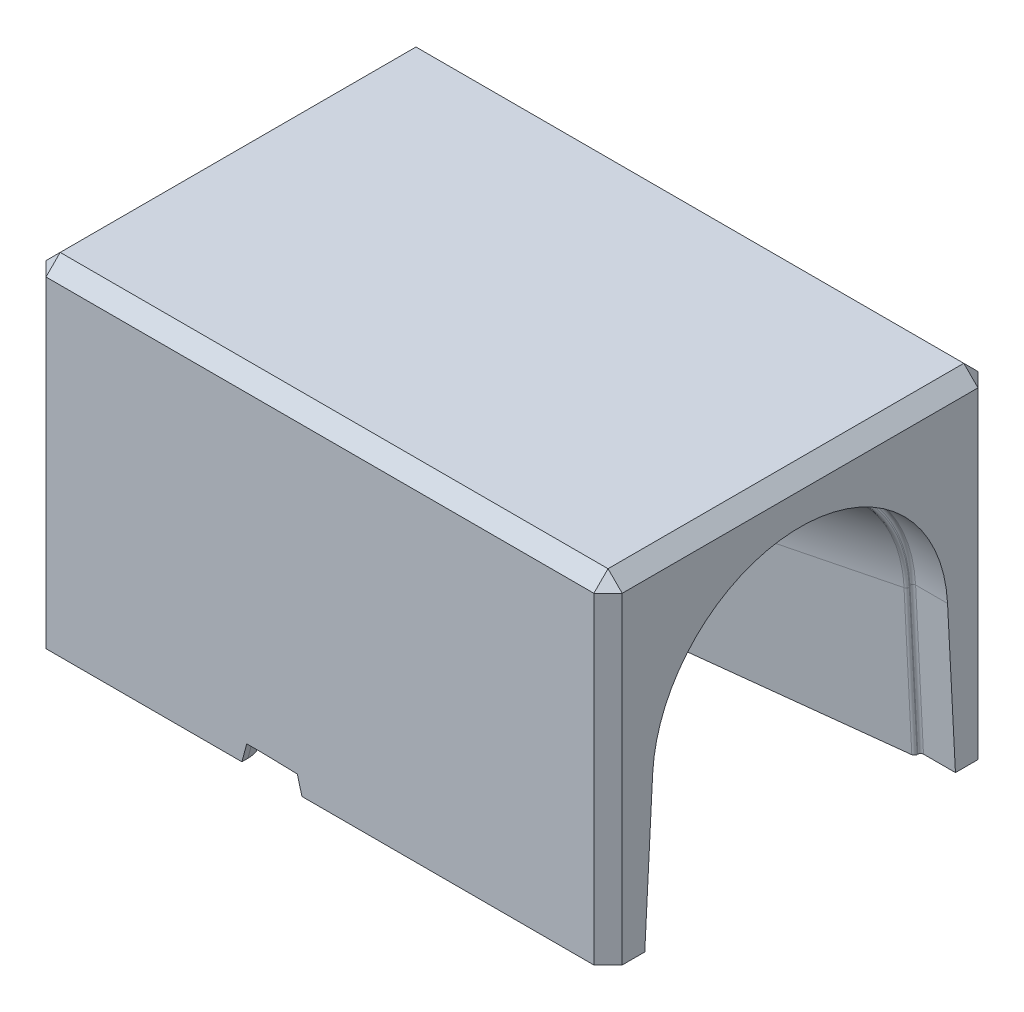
SolidWorks part; units mm, degrees
ref_plane "Front Plane" through (0, 0, 0) normal (0, 0, 1) x (1, 0, 0)
ref_plane "Top Plane" through (0, 0, 0) normal (0, 1, 0) x (1, 0, 0)
ref_plane "Right Plane" through (0, 0, 0) normal (1, 0, 0) x (0, 0, -1)
sketch "Sketch1" plane through (0, 0, 0) normal (0, 1, 0) x (1, 0, 0)
  line L5 (-304.8, 203.2) -> (304.8, 203.2)
  line L6 (-304.8, 203.2) -> (-304.8, -203.2)
  line L7 (-304.8, -203.2) -> (304.8, -203.2)
  line L8 (304.8, 203.2) -> (304.8, -203.2)
  line L9 (-304.8, 203.2) -> (304.8, -203.2) construction
  line L10 (-304.8, -203.2) -> (304.8, 203.2) construction
  point P0 (0, 0)
  dimension "D1" = 406.4
  dimension "D2" = 609.6
extrude "Boss-Extrude1" add sketch "Sketch1" along normal blind 355.6
other "Cavity1"
other "die_demo_2020-2<3>@die_demo-a2"
sketch "Sketch2" plane through (-270, 0, 0) normal (1, 0, 0) x (0, 0, -1)
  line L6 (-101.0245, 0) -> (-98.318, 0)
  line L8 (-91.6098, 0) -> (-3.3541, 0)
  line L10 (3.3541, 0) -> (91.6098, 0)
  line L11 (98.318, 0) -> (101.0245, 0)
  line L12 (101.0245, 0) -> (95.9918, 96.0307)
  line L13 (-95.9918, 96.0307) -> (-101.0245, 0)
  line L22 (-101.0245, 0) -> (-98.318, 0)
  line L23 (-91.6098, 0) -> (-3.3541, 0)
  line L24 (3.3541, 0) -> (91.6098, 0)
  line L25 (98.318, 0) -> (101.0245, 0)
  line L26 (101.0245, 0) -> (95.9918, 96.0307)
  line L27 (-95.9918, 96.0307) -> (-101.0245, 0)
  arc A4 (-91.6098, 0) -> (-98.318, 0) centre (-94.9639, 1) ccw
  arc A6 (3.3541, 0) -> (-3.3541, 0) centre (0, 1) ccw
  arc A7 (98.318, 0) -> (91.6098, 0) centre (94.9639, 1) ccw
  arc A8 (95.9918, 96.0307) -> (-95.9918, 96.0307) centre (0, 91) ccw
  arc A9 (-91.6098, 0) -> (-98.318, 0) centre (-94.9639, 1) ccw
  arc A15 (3.3541, 0) -> (-3.3541, 0) centre (0, 1) ccw
  arc A16 (98.318, 0) -> (91.6098, 0) centre (94.9639, 1) ccw
  arc A17 (95.9918, 96.0307) -> (-95.9918, 96.0307) centre (0, 91) ccw
  dimension "D1" = 0
extrude "Cut-Extrude1" cut sketch "Sketch2" against normal blind 60
sketch "Sketch3" plane through (280, 0, 0) normal (-1, 0, 0) x (0, 0, 1)
  line L7 (164.3338, 0) -> (155.9918, 159.1752)
  line L8 (-155.9918, 159.1752) -> (-164.3338, 0)
  line L9 (-164.3338, 0) -> (-161.6273, 0)
  line L10 (-154.9191, 0) -> (-68.3541, 0)
  line L11 (-61.6459, 0) -> (61.6459, 0)
  line L12 (68.3541, 0) -> (154.9191, 0)
  line L14 (161.6273, 0) -> (164.3338, 0)
  line L15 (164.3338, 0) -> (155.9918, 159.1752)
  line L24 (-155.9918, 159.1752) -> (-164.3338, 0)
  line L25 (-164.3338, 0) -> (-161.6273, 0)
  line L26 (-154.9191, 0) -> (-68.3541, 0)
  line L27 (-61.6459, 0) -> (61.6459, 0)
  line L28 (68.3541, 0) -> (154.9191, 0)
  line L29 (161.6273, 0) -> (164.3338, 0)
  arc A5 (155.9918, 159.1752) -> (-155.9918, 159.1752) centre (0, 151) ccw
  arc A6 (-154.9191, 0) -> (-161.6273, 0) centre (-158.2732, 1) ccw
  arc A7 (-61.6459, 0) -> (-68.3541, 0) centre (-65, 1) ccw
  arc A8 (68.3541, 0) -> (61.6459, 0) centre (65, 1) ccw
  arc A9 (161.6273, 0) -> (154.9191, 0) centre (158.2732, 1) ccw
  arc A10 (155.9918, 159.1752) -> (-155.9918, 159.1752) centre (0, 151) ccw
  arc A11 (-154.9191, 0) -> (-161.6273, 0) centre (-158.2732, 1) ccw
  arc A18 (-61.6459, 0) -> (-68.3541, 0) centre (-65, 1) ccw
  arc A19 (68.3541, 0) -> (61.6459, 0) centre (65, 1) ccw
  arc A20 (161.6273, 0) -> (154.9191, 0) centre (158.2732, 1) ccw
  dimension "D1" = 0
extrude "Cut-Extrude2" cut sketch "Sketch3" against normal blind 60 contours L15 A10 L24 L25 A11 L26 A18 L27 A19 L28 A20 L29
chamfer "Chamfer1" distance 15 angle 45 8 edges at (-304.8, 355.6, 0) (-304.8, 177.8, 203.2) (0, 355.6, 203.2) (-304.8, 177.8, -203.2) (0, 355.6, -203.2) (304.8, 177.8, -203.2) (304.8, 355.6, 0) (304.8, 177.8, 203.2)
other "Cavity2"
other "gating-0^die_demo-a2<1>@die_demo-a2"
sketch "Sketch7" plane through (-216.1057, 0, -24.8754) normal (0.9934, 0, 0.1144) x (0.1144, 0, -0.9934)
  line L0 (-126.263, 0) -> (-128.1546, 0)
  line L1 (-130.0461, 0) -> (-126.263, 0) construction
  line L2 (-128.1546, 0) -> (-127.735, 1.524)
  line L3 (-126.211, 1.524) -> (-129.259, 1.524) construction
  line L4 (-127.735, 1.524) -> (-126.1837, 1.524)
  line L5 (-126.1837, 1.524) -> (-126.263, 0)
  line L7 (-126.263, 0) -> (-126.211, 1) construction
extrude "Cut-Extrude4" cut sketch "Sketch7" along normal up to surface (473.7552 mm away)
